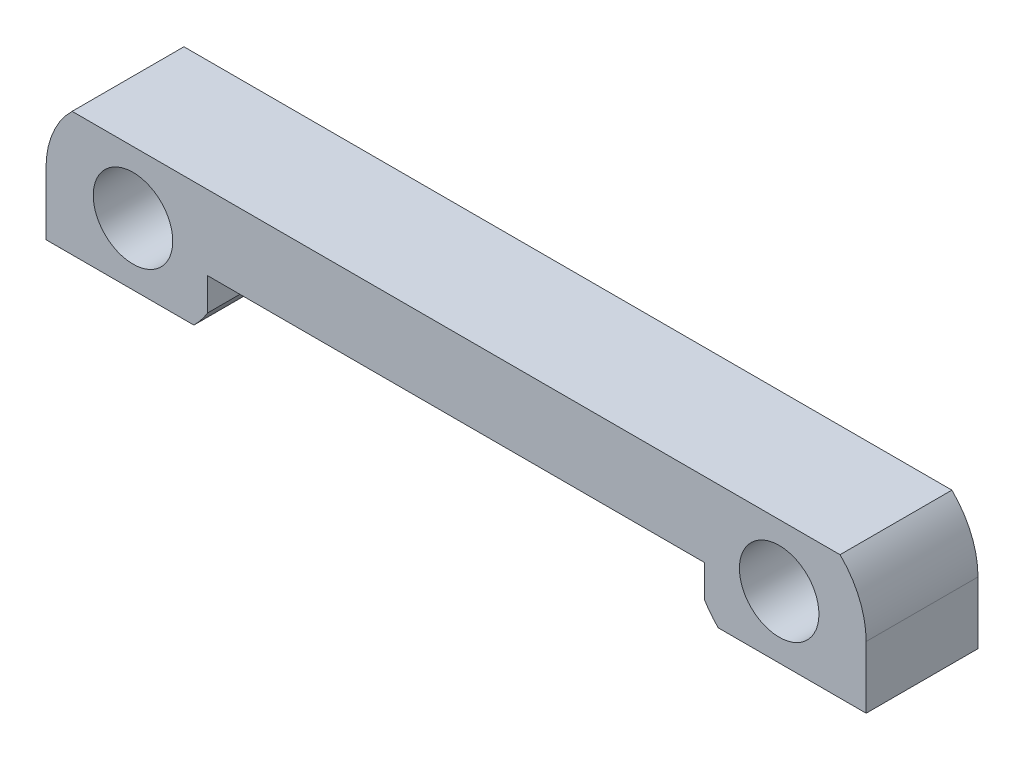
SolidWorks part; units mm, degrees
ref_plane "Спереди" through (0, 0, 0) normal (0, 0, 1) x (1, 0, 0)
ref_plane "Сверху" through (0, 0, 0) normal (0, 1, 0) x (1, 0, 0)
ref_plane "Справа" through (0, 0, 0) normal (1, 0, 0) x (0, 0, -1)
other "Configuration Table"
sketch "Эскиз1" plane through (0, 0, 0) normal (0, 1, 0) x (1, 0, 0)
  line L1 (-19.1549, 8.3385) -> (13.8451, 8.3385)
  line L2 (-19.1549, 8.3385) -> (-19.1549, 3.8385)
  line L3 (-19.1549, 3.8385) -> (13.8451, 3.8385)
  line L4 (13.8451, 8.3385) -> (13.8451, 3.8385)
  dimension "D1" = 33
  dimension "D2" = 4.5
extrude "Бобышка-Вытянуть1" add sketch "Эскиз1" along normal blind 5
sketch "Эскиз2" plane through (0, 0, -3.8385) normal (0, 0, 1) x (1, 0, 0)
  line L8 (-22.6889, 2.5) -> (16.7603, 2.5) construction
  line L9 (-12.6549, 5) -> (-12.6549, 0)
  line L10 (7.3451, 5) -> (7.3451, 0)
  line L11 (-12.6549, 2) -> (7.3451, 2)
  line L13 (-19.1549, 0) -> (13.8451, 0)
  line L14 (13.8451, 0) -> (13.8451, 5)
  line L15 (13.8451, 5) -> (-19.1549, 5)
  line L16 (-19.1549, 5) -> (-19.1549, 0)
  line L17 (-19.1549, 0) -> (13.8451, 0)
  line L18 (13.8451, 0) -> (13.8451, 5)
  line L19 (13.8451, 5) -> (-19.1549, 5)
  line L20 (-19.1549, 5) -> (-19.1549, 0)
  line L21 (-19.1549, 5) -> (13.8451, 5)
  line L22 (-19.1549, 5) -> (-19.1549, 6)
  line L23 (-19.1549, 6) -> (13.8451, 6)
  line L24 (13.8451, 5) -> (13.8451, 6)
  circle A2 centre (-15.6549, 2.5) radius 1.6
  circle A3 centre (10.3451, 2.5) radius 1.6
  circle A4 centre (-15.6549, 2.5) radius 3.5
  circle A5 centre (10.3451, 2.5) radius 3.5
  dimension "D2" = 2.5
  dimension "D3" = 3.5
  dimension "D4" = 3.5
  dimension "D5" = 6.5
  dimension "D6" = 6.5
  dimension "D7" = 2
  dimension "D8" = 1
  dimension "D1" = 0
extrude "Вырез-Вытянуть1" cut sketch "Эскиз2" against normal blind 5 contours L9 A4 L11 | A5 L11 A4 L9 L10 M18 | A4 L9 M18 | L11 A5 L10 | A5 L10 M18 | A2 L8 | L8 A2 | A3 L8 | L8 A3 | A4 M20 M21 | A5 L18 M20
